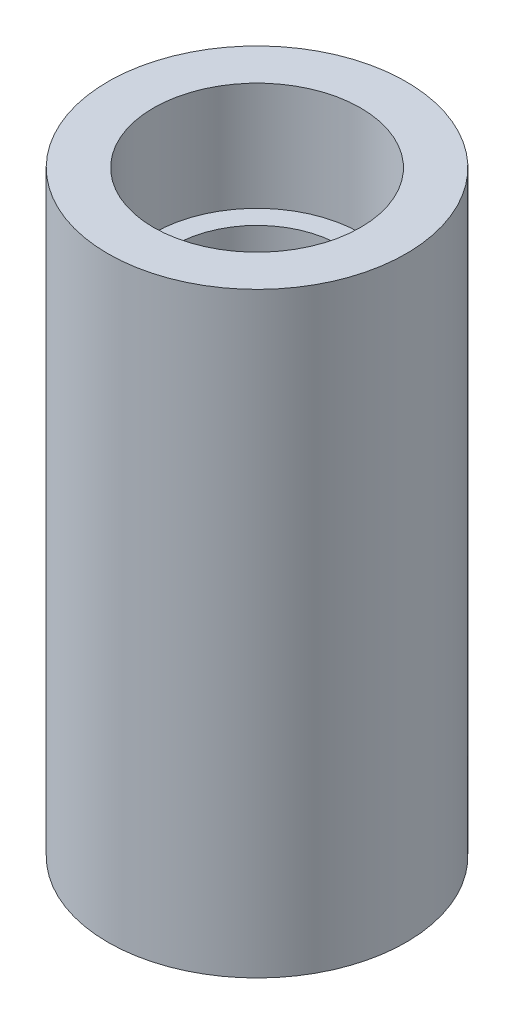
SolidWorks part; units mm, degrees
ref_plane "Front" through (0, 0, 0) normal (0, 0, 1) x (1, 0, 0)
ref_plane "Top" through (0, 0, 0) normal (0, 1, 0) x (1, 0, 0)
ref_plane "Right" through (0, 0, 0) normal (1, 0, 0) x (0, 0, -1)
sketch "Sketch1" plane through (0, 0, 0) normal (0, 1, 0) x (1, 0, 0)
  circle A0 centre (0, 0) radius 6.985
  dimension "D1" = 13.97
extrude "Boss-Extrude1" add sketch "Sketch1" along normal blind 27.94
sketch "Sketch2" plane through (0, 27.94, 0) normal (0, 1, 0) x (1, 0, 0)
  circle A0 centre (0, 0) radius 4.8514
  dimension "D1" = 9.7028
extrude "Cut-Extrude1" cut sketch "Sketch2" against normal blind 5.08
sketch "Sketch3" plane through (0, 22.86, 0) normal (0, 1, 0) x (1, 0, 0)
  circle A0 centre (0, 0) radius 3.8735
  dimension "D1" = 7.747
extrude "Cut-Extrude2" cut sketch "Sketch3" against normal blind 2.54
sketch "Sketch4" plane through (0, 0, 0) normal (0, -1, 0) x (1, 0, 0)
  circle A0 centre (0, 0) radius 4.7625
  dimension "D1" = 9.525
extrude "Cut-Extrude3" cut sketch "Sketch4" against normal blind 20.32
